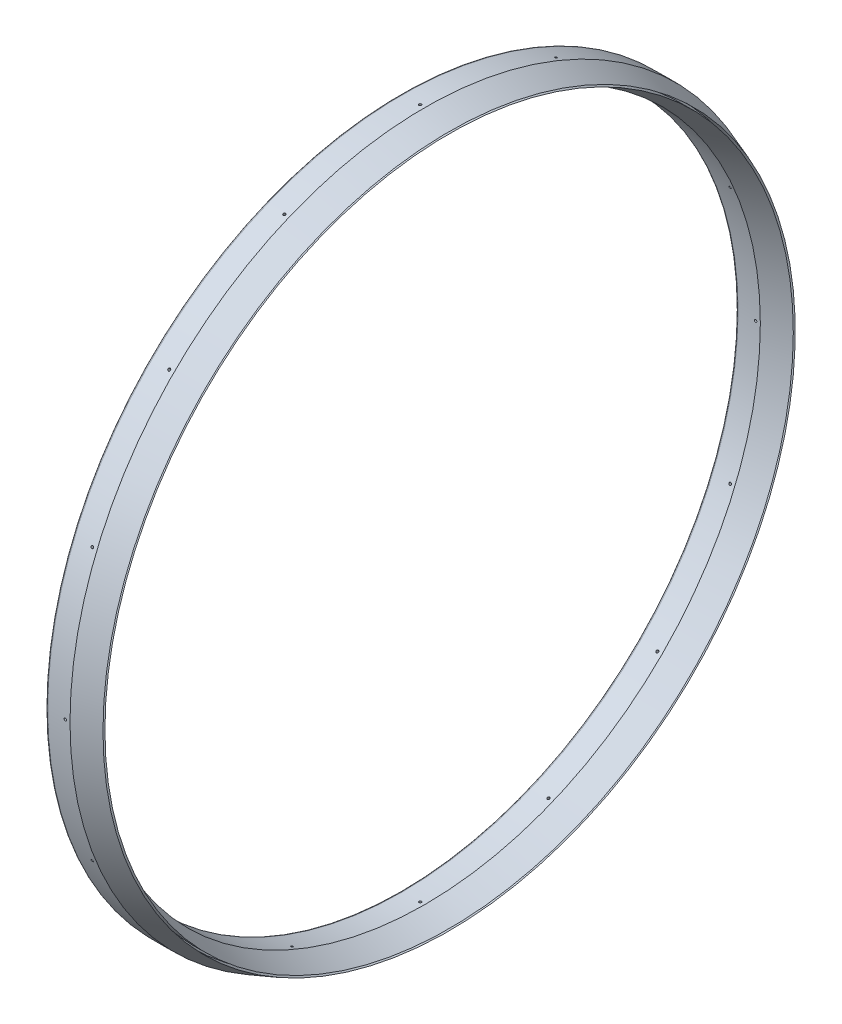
SolidWorks part; units mm, degrees
other "DetailItem1"
ref_plane "Front Plane" through (0, 0, 0) normal (0, 0, 1) x (1, 0, 0)
ref_plane "Top Plane" through (0, 0, 0) normal (0, 1, 0) x (1, 0, 0)
ref_plane "Right Plane" through (0, 0, 0) normal (1, 0, 0) x (0, 0, -1)
sketch "Sketch1" plane through (0, 0, 0) normal (0, 0, 1) x (1, 0, 0)
  line L0 (-102.6213, 0) -> (114.7318, 0) construction
  line L1 (0, 171.1472) -> (0, 181.9) construction
  line L2 (-110.9075, 171.9) -> (60.9626, 171.9) construction
  line L3 (-12.4, 171.9) -> (-12.4, 181.9)
  line L4 (0, 181.9) -> (12.4, 177.4)
  line L5 (0, 162.814) -> (0, -96.0348) construction
  line L6 (12.4, 177.4) -> (6, 177.4)
  line L7 (6, 176.4) -> (12.4, 176.4)
  line L8 (12.4, 176.4) -> (0, 171.9)
  line L9 (0, 171.9) -> (-12.4, 171.9)
  line L10 (-12.4, 181.9) -> (0, 181.9)
  line L11 (-19.7531, 176.9) -> (35.4989, 176.9) construction
  line L12 (6, 176.4) -> (6, 177.4)
  point P23 (-12.4, 171.9)
  point P26 (-12.4, 181.9)
  dimension "D2" = 10
  dimension "D3" = 12.4
  dimension "D4" = 6.4
  dimension "D5" = 176.9
  dimension "D6" = 1
  dimension "D10" = 12.4
revolve "Revolve1" add sketch "Sketch1" angle 360 about L0
sketch "Sketch2" plane through (-12.4, 0, 0) normal (-1, 0, 0) x (0, 0, 1)
  line L0 (0, 186.4111) -> (0, -183.0509) construction
  line L1 (-191.8665, 0) -> (193.8486, 0) construction
  circle A0 centre (0, 0) radius 176.9 construction
  circle A1 centre (0, 176.9) radius 1.1303
  dimension "D1" = 353.8
  dimension "D2" = 2.2606
extrude "Cut-Extrude1" cut sketch "Sketch2" against normal blind 12.7
pattern_circular "CirPattern1" [suppressed] count 24 over 360
sketch "Sketch3" plane through (0, 0, 0) normal (0, 1, 0) x (1, 0, 0)
  line L0 (-55.9862, 0) -> (60.6517, 0) construction
  line L1 (0, -181.9) -> (0, 181.9) construction
  line L2 (-19.05, 15.875) -> (19.05, 15.875)
  line L3 (-19.05, 15.875) -> (-19.05, -15.875)
  line L4 (-19.05, -15.875) -> (19.05, -15.875)
  line L5 (19.05, 15.875) -> (19.05, -15.875)
  dimension "D1" = 15.875
  dimension "D2" = 15.875
  dimension "D3" = 19.05
  dimension "D4" = 19.05
extrude "Cut-Extrude2" [suppressed] cut sketch "Sketch3" along normal blind 177.8
sketch "Sketch4" plane through (0, 0, 0) normal (0, 0, 1) x (1, 0, 0)
  line L1 (0, -181.9) -> (0, 181.9) construction
  line L2 (-12.4, 181.9) -> (-12.4, -181.9) construction
  line L3 (0, 167.64) -> (-12.4, 167.64)
  line L4 (0, 167.64) -> (-2.54, 167.64)
  line L6 (0, 165.1) -> (-12.4, 165.1)
  line L7 (-12.4, 167.64) -> (-12.4, 165.1)
  line L8 (-46.9315, 0) -> (51.661, 0) construction
  line L9 (0, 165.1) -> (-2.54, 165.1)
  line L10 (-2.54, 167.64) -> (-2.54, 165.1)
  dimension "D1" = 2.54
  dimension "D2" = 167.64
  dimension "D3" = 2.54
revolve "Cut-Revolve1" [suppressed] cut sketch "Sketch4" angle 360 about L8
hole_wizard "M5x0.8 Tapped Hole1" positions "3DSketch1" profile "Sketch5" tap size "M5x0.8" standard "Ansi Metric"
sketch3d "3DSketch1"
  point P0 (-12.4, 176.9, 0)
sketch "Sketch5" plane through (-12.4, 176.9, 0) normal (0, 1, 0) x (0, 0, 1)
  line L0 (0, 0) -> (0, 11.6618)
  line L1 (0, 11.6618) -> (2.1, 10.4)
  line L2 (2.1, 10.4) -> (2.1, 0)
  line L5 (2.1, 0) -> (0, 0)
  line L10 (0, 11.6618) -> (-2.1, 10.4) construction
  line L11 (0, -6.35) -> (0, 107.95) construction
  dimension "Tap Drill Dia." = 4.2
  dimension "Tap Drill Depth" = 10.4
  dimension "Drill Angle" = 118
sketch "Sketch6" plane through (0, 0, 0) normal (0, 1, 0) x (1, 0, 0)
  line L0 (-16.515, 0) -> (17.3917, 0) construction
  circle A0 centre (-2.4122, 0) radius 0.635
  dimension "D1" = 1.27
extrude "Cut-Extrude3" cut sketch "Sketch6" against normal blind 300
pattern_circular "CirPattern7" count 16 over 360 about axis through (-102.6213, 0, 0) along (-1, 0, 0) of "Cut-Extrude3"
pattern_circular "CirPattern8" count 16 over 360 about axis through (0, 0, 0) along (1, 0, 0) of "M5x0.8 Tapped Hole1"
fillet "Fillet1" radius 1 2 edges at (-12.4, 0, 171.9) (-12.4, 0, 181.9)
